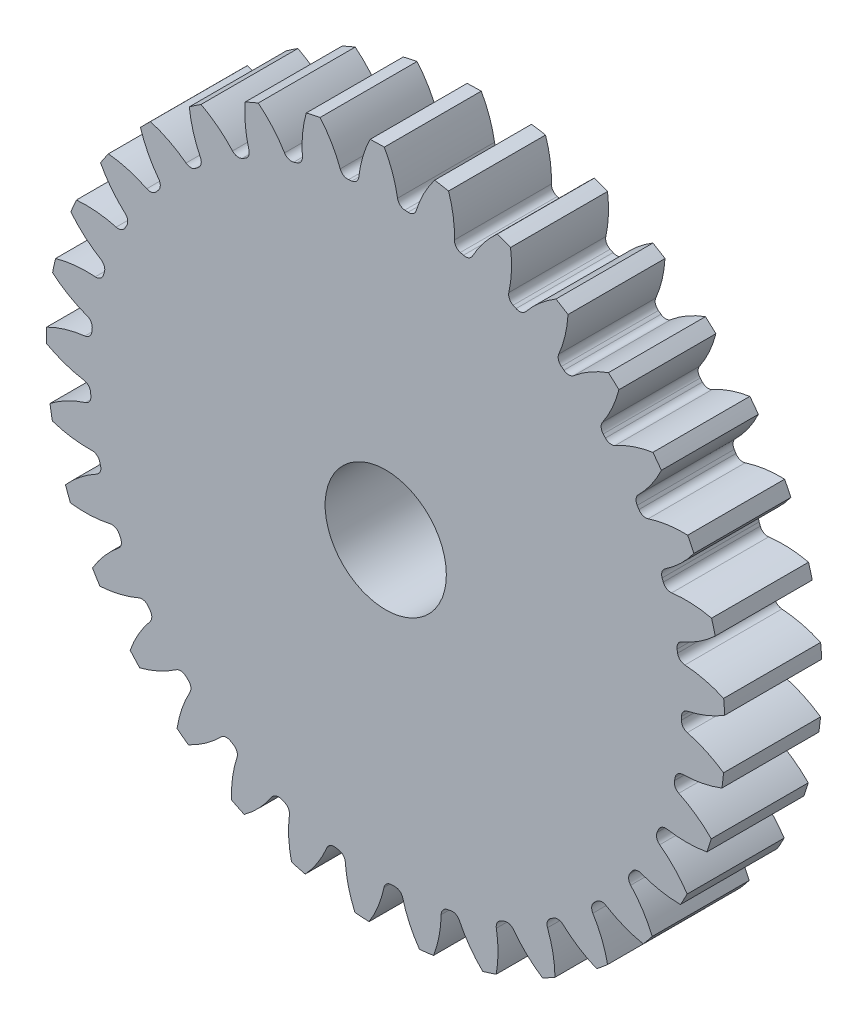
SolidWorks part; units mm, degrees
ref_plane "Front" through (0, 0, 0) normal (0, 0, 1) x (1, 0, 0)
ref_plane "Top" through (0, 0, 0) normal (0, 1, 0) x (1, 0, 0)
ref_plane "Right" through (0, 0, 0) normal (1, 0, 0) x (0, 0, -1)
sketch "Sketch3" plane through (0, 0, 0) normal (0, 0, 1) x (1, 0, 0)
  circle A0 centre (0, 0) radius 355.6
  dimension "od" = 711.2
extrude "gearBody" add sketch "Sketch3" along normal blind 101.6
sketch "Sketch2" plane through (0, 0, 0) normal (0, 0, 1) x (1, 0, 0)
  line L0 (0, 0) -> (291.0776, 120.5683) construction
  line L1 (354.3998, -34.6878) -> (0, 0) construction
  line L2 (0, 0) -> (36.3143, 0) construction
  line L3 (335.1755, 8.372) -> (334.4614, -23.4155) construction
  line L5 (334.8184, -7.5217) -> (0, 0) construction
  line L7 (0, 0) -> (315.0601, 0) construction
  arc A0 (315.0508, 2.4247) -> (314.6241, -16.5704) centre (0, 0) ccw construction
  arc A1 (355.1218, 18.4362) -> (353.9356, -34.3652) centre (0, 0) ccw construction
  arc A2 (335.1755, 8.372) -> (334.4614, -23.4155) centre (0, 0) ccw construction
  arc A3 (309.7586, -8.673) -> (309.8356, -5.2462) centre (0, 0) ccw
  arc A4 (354.3998, -34.6878) -> (315.9291, -16.9046) centre (285.3696, -133.5182) ccw
  arc A5 (354.3998, -34.6878) -> (355.6, 18.7376) centre (0, 0) ccw
  arc A6 (355.6, 18.7376) -> (316.3695, 2.7) centre (291.0776, 120.5683) cw
  arc A7 (309.8356, -5.2462) -> (316.3695, 2.7) centre (318.1046, -5.3862) cw
  arc A8 (315.9291, -16.9046) -> (309.7586, -8.673) centre (318.0256, -8.9045) cw
  point P6 (355.6, 18.7376)
  point P22 (354.3998, -34.6878)
  dimension "baseDia" = 630.1203
  dimension "od" = 711.2
  dimension "pd" = 670.56
  dimension "rd" = 619.76
  dimension "rFillet" = 8.2702
  dimension "pointX" = 355.6
  dimension "pointY" = 18.7376
  dimension "CTT" = 31.7875
  dimension "flankCenterAngle" = 22.5
extrude "toothCut" cut sketch "Sketch2" along normal through all
pattern_circular "CirPattern1" count 33 over 360 about axis through (0, 0, 0) along (0, 0, 1) of "toothCut"
sketch "hub1Dia" plane through (0, 0, 0) normal (0, 0, -1) x (-1, 0, 0)
  circle A0 centre (0, 0) radius 12.7
  dimension "hub1Dia" = 25.4
sketch "hub2Dia" plane through (0, 0, 101.6) normal (0, 0, 1) x (1, 0, 0)
  circle A0 centre (0, 0) radius 12.7
  dimension "hub2dia" = 25.4
sketch "boreDia" plane through (0, 0, 0) normal (0, 0, 1) x (1, 0, 0)
  circle A0 centre (0, 0) radius 63.5
  dimension "boreDia" = 127
extrude "bore" cut sketch "boreDia" against normal mid plane 25400
